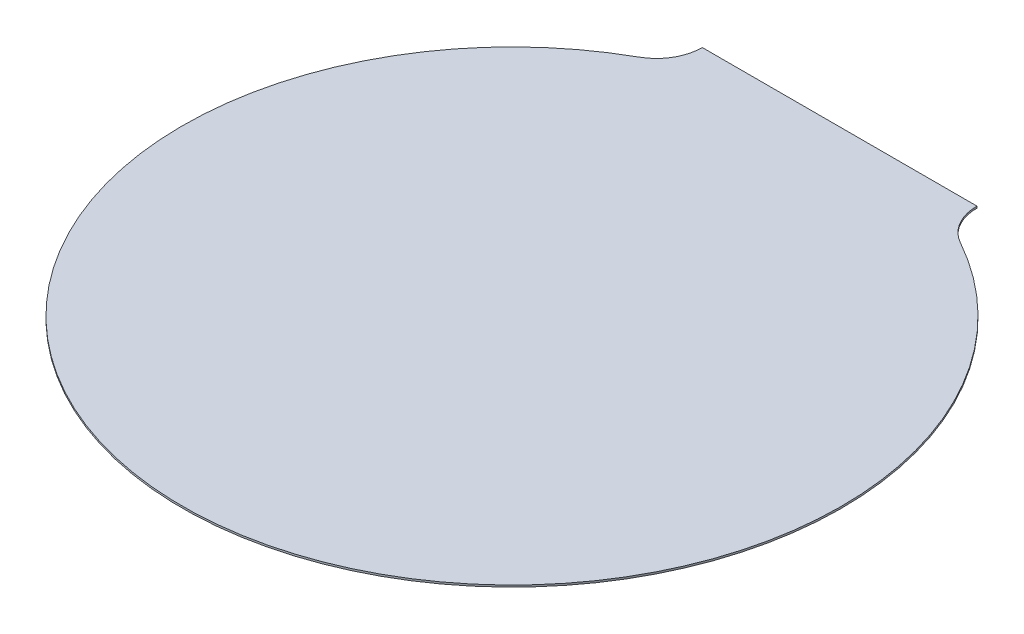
SolidWorks part; units mm, degrees
ref_plane "Front" through (0, 0, 0) normal (0, 0, 1) x (1, 0, 0)
ref_plane "Top" through (0, 0, 0) normal (0, 1, 0) x (1, 0, 0)
ref_plane "Right" through (0, 0, 0) normal (1, 0, 0) x (0, 0, -1)
sketch "Sketch1" plane through (0, 0, 0) normal (0, 1, 0) x (1, 0, 0)
  line L0 (3.8097, 9.0911) -> (-3.8097, 9.0911)
  arc A0 (-4.4602, 7.9824) -> (4.4602, 7.9824) centre (0, 0) ccw
  arc A1 (-4.4602, 7.9824) -> (-3.8097, 9.0911) centre (-5.0797, 9.0911) ccw
  arc A2 (3.8097, 9.0911) -> (4.4602, 7.9824) centre (5.0797, 9.0911) ccw
extrude "Extrude1" add sketch "Sketch1" along normal blind 0.0508
